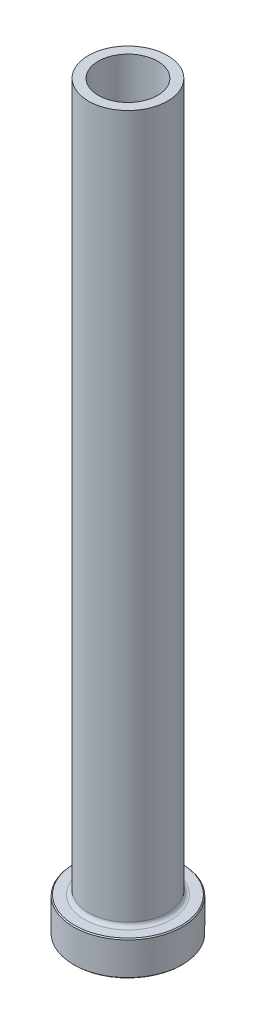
SolidWorks part; units mm, degrees
ref_plane "Front Plane" through (0, 0, 0) normal (0, 0, 1) x (1, 0, 0)
ref_plane "Top Plane" through (0, 0, 0) normal (0, 1, 0) x (1, 0, 0)
ref_plane "Right Plane" through (0, 0, 0) normal (1, 0, 0) x (0, 0, -1)
sketch "Sketch1" plane through (0, 0, 0) normal (0, 0, 1) x (1, 0, 0)
  line L0 (-6, 150) -> (-8, 150)
  line L1 (-8, 150) -> (-8, 7)
  line L2 (-8, 7) -> (-11, 7)
  line L3 (-11, 7) -> (-11, 0)
  line L4 (12.1, 0) -> (-12.1, 0) construction
  line L5 (-11, 0) -> (-6.25, 0)
  line L6 (-6, 95) -> (-6, 150)
  line L7 (0, 92.1877) -> (0, -15.5353) construction
  line L8 (0, -12.1) -> (0, 12.1) construction
  line L9 (-6, 95) -> (-6.25, 83)
  line L10 (-6.25, 83) -> (-6.25, 0)
  dimension "D1" = 0.25
  dimension "ID" = 12
  dimension "OD" = 16
  dimension "L" = 150
  dimension "H" = 22
  dimension "T" = 7
  dimension "N" = 55
  dimension "D2" = 12
revolve "Revolve1" add sketch "Sketch1" angle 360 about L7
fillet "Fillet1" radius 0.8 1 edges at (0, 7, 8)
chamfer "Chamfer1" distance 0.2 angle 45 2 edges at (0, 7, 11) (0, 0, 11)
chamfer "Chamfer3" distance 0.5 angle 45 1 edges at (0, 0, 6.25)
